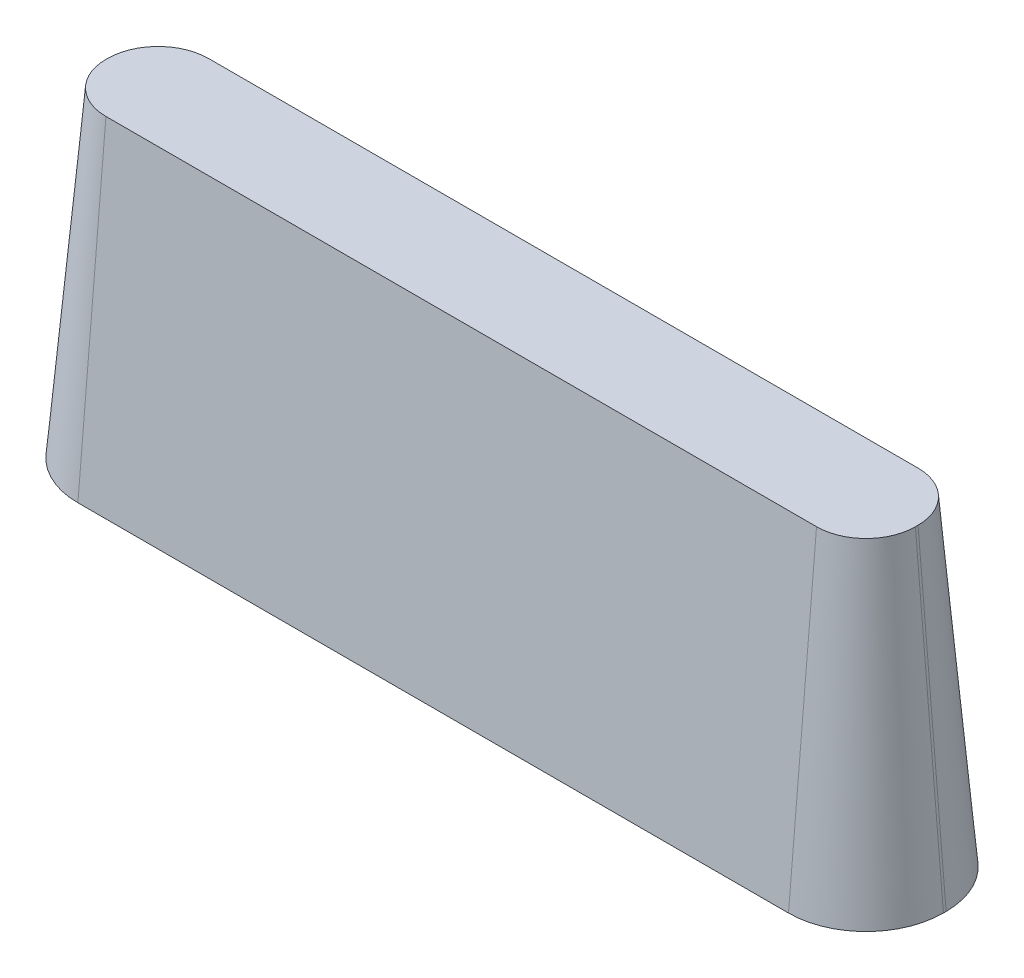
SolidWorks part; units mm, degrees
ref_plane "Front Plane" through (0, 0, 0) normal (0, 0, 1) x (1, 0, 0)
ref_plane "Top Plane" through (0, 0, 0) normal (0, 1, 0) x (1, 0, 0)
ref_plane "Right Plane" through (0, 0, 0) normal (1, 0, 0) x (0, 0, -1)
sketch "Sketch1" plane through (0, 0, 0) normal (0, 1, 0) x (1, 0, 0)
  line L0 (79.4098, 442.3964) -> (1428.1498, 442.3964)
  line L1 (79.4098, 444.9364) -> (1428.1498, 444.9364)
  line L2 (-72.9902, 292.5364) -> (-72.9902, 289.9964)
  line L3 (76.8698, 140.1364) -> (1428.1498, 140.1364)
  line L4 (1578.0098, 295.0764) -> (1578.0098, 289.9964)
  line L5 (1575.4698, 295.0764) -> (1575.4698, 289.9964)
  line L6 (76.8698, 142.6764) -> (1428.1498, 142.6764)
  line L7 (-70.4502, 292.5364) -> (-70.4502, 289.9964)
  arc A0 (-72.9902, 292.5364) -> (79.4098, 444.9364) centre (79.4098, 292.5364) cw
  arc A1 (76.8698, 140.1364) -> (-72.9902, 289.9964) centre (76.8698, 289.9964) cw
  arc A2 (1578.0098, 289.9964) -> (1428.1498, 140.1364) centre (1428.1498, 289.9964) cw
  arc A3 (1428.1498, 444.9364) -> (1578.0098, 295.0764) centre (1428.1498, 295.0764) cw
  arc A4 (1428.1498, 442.3964) -> (1575.4698, 295.0764) centre (1428.1498, 295.0764) cw
  arc A5 (1575.4698, 289.9964) -> (1428.1498, 142.6764) centre (1428.1498, 289.9964) cw
  arc A6 (76.8698, 142.6764) -> (-70.4502, 289.9964) centre (76.8698, 289.9964) cw
  arc A7 (-70.4502, 292.5364) -> (79.4098, 442.3964) centre (79.4098, 292.5364) cw
  point P6 (-72.9902, 444.9364)
  point P9 (-72.9902, 140.1364)
  point P12 (1578.0098, 140.1364)
  dimension "D3" = 152.4
  dimension "D4" = 149.86
  dimension "D5" = 149.86
  dimension "D1" = 1651
  dimension "D2" = 304.8
  dimension "D6" = 2.54
extrude "Extrude1" add sketch "Sketch1" along normal blind 609.6 draft 5 contours A7 L7 A6 L6 A5 L5 A4 L0
ref_plane "Plane1" through (0, 2.54, 0) normal (0, -1, 0) x (1, 0, 0)
sketch "Sketch2" plane through (0, 2.54, 0) normal (0, -1, 0) x (1, 0, 0)
  line L23 (79.4098, -439.8564) -> (1428.1498, -439.8564)
  line L24 (1572.9298, -295.0764) -> (1572.9298, -289.9964)
  line L25 (1428.1498, -145.2164) -> (76.8698, -145.2164)
  line L26 (-67.9102, -289.9964) -> (-67.9102, -292.5364)
  line L27 (79.4098, -439.8564) -> (1428.1498, -439.8564)
  line L28 (1572.9298, -295.0764) -> (1572.9298, -289.9964)
  line L29 (1428.1498, -145.2164) -> (76.8698, -145.2164)
  line L30 (-67.9102, -289.9964) -> (-67.9102, -292.5364)
  arc A34 (-67.9102, -292.5364) -> (79.4098, -439.8564) centre (79.4098, -292.5364) ccw
  arc A35 (1428.1498, -439.8564) -> (1572.9298, -295.0764) centre (1428.1498, -295.0764) ccw
  arc A36 (1572.9298, -289.9964) -> (1428.1498, -145.2164) centre (1428.1498, -289.9964) ccw
  arc A37 (76.8698, -145.2164) -> (-67.9102, -289.9964) centre (76.8698, -289.9964) ccw
  arc A38 (-67.9102, -292.5364) -> (79.4098, -439.8564) centre (79.4098, -292.5364) ccw
  arc A39 (1428.1498, -439.8564) -> (1572.9298, -295.0764) centre (1428.1498, -295.0764) ccw
  arc A40 (1572.9298, -289.9964) -> (1428.1498, -145.2164) centre (1428.1498, -289.9964) ccw
  arc A41 (76.8698, -145.2164) -> (-67.9102, -289.9964) centre (76.8698, -289.9964) ccw
  dimension "D1" = 2.54
extrude "Cut-Extrude1" cut sketch "Sketch2" against normal blind 604.52 draft 5
